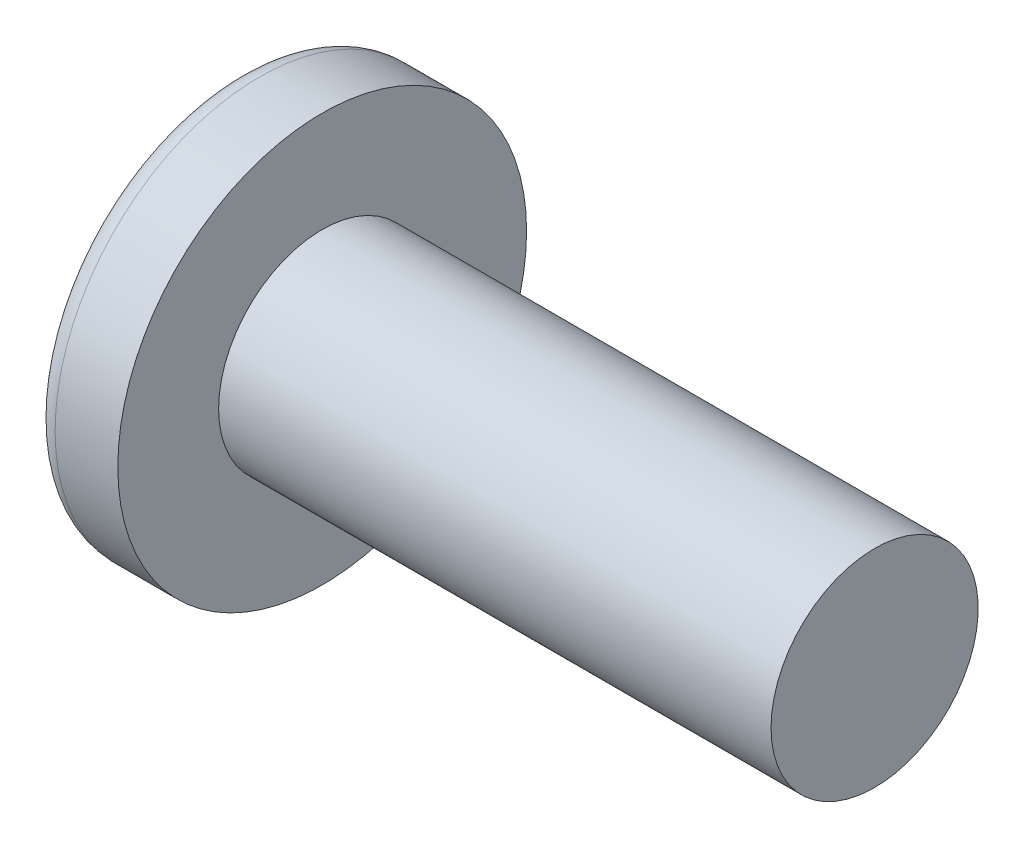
SolidWorks part; units mm, degrees
ref_plane "Plane1" through (0, 0, 0) normal (0, 0, 1) x (1, 0, 0)
ref_plane "Plane2" through (0, 0, 0) normal (0, 1, 0) x (1, 0, 0)
ref_plane "Plane3" through (0, 0, 0) normal (1, 0, 0) x (0, 0, -1)
sketch "BodySke" plane through (0, 0, 0) normal (0, 0, 1) x (1, 0, 0)
  line L0 (6.6294, 4.7625) -> (6.6294, 9.398)
  line L1 (7.159, 6.35) -> (7.159, -3.175) construction
  line L2 (-25.4, 0) -> (127, 0) construction
  line L3 (32.0294, 0) -> (0, 0)
  line L4 (6.6294, 4.7625) -> (32.0294, 4.7625)
  line L5 (32.0294, 4.7625) -> (32.0294, 0)
  line L6 (3.7481, 9.398) -> (6.6294, 9.398)
  line L7 (6.6294, -4.7625) -> (32.0294, -4.7625) construction
  line L8 (6.6294, 6.35) -> (6.6294, -3.175) construction
  arc A0 (2.9272, 8.9807) -> (0, 0) centre (15.24, 0) ccw
  arc A2 (2.9272, 8.9807) -> (3.7481, 9.398) centre (3.7481, 8.382) cw
revolve "Base-Revolve" add sketch "BodySke" angle 360 about L2
sketch "Sketch3" plane through (0, 0, 0) normal (1, 0, 0) x (0, 0, -1)
  line L0 (1.0287, -6.096) -> (-1.0287, -6.096)
  line L1 (1.0287, -6.096) -> (1.0287, 6.096)
  line L2 (-1.0287, 6.096) -> (1.0287, 6.096)
  line L3 (-1.0287, 6.096) -> (-1.0287, -6.096)
ref_plane "Plane4" through (7.2644, 0, 0) normal (1, 0, 0) x (0, 0, -1)
sketch "Sketch4" plane through (7.2644, 0, 0) normal (1, 0, 0) x (0, 0, -1)
  line L0 (0.5143, -0.5143) -> (-0.5143, -0.5144)
  line L1 (0.5143, -0.5143) -> (0.5143, 0.5143)
  line L2 (-0.5143, 0.5143) -> (0.5143, 0.5143)
  line L3 (-0.5143, 0.5143) -> (-0.5143, -0.5144)
loft "Cut-Loft1" cut profiles "Sketch3", "Sketch4"
pattern_circular "CirPattern1" count 2 every 90 about axis through (0, 0, 0) along (1, 0, 0) of "Cut-Loft1"
sketch "ThdSchSke" plane through (0, 0, 0) normal (0, 0, 1) x (1, 0, 0)
  line L0 (7.6886, -4.1326) -> (7.2475, -4.7625)
  line L1 (7.6886, -4.1326) -> (8.1297, -4.7625)
  line L2 (8.1297, -4.7625) -> (8.1297, -5.9531)
  line L3 (-3.175, 0) -> (5.1513, 0) construction
  line L5 (8.1297, -5.9531) -> (7.2475, -5.9531)
  line L6 (7.2475, -5.9531) -> (7.2475, -4.7625)
revolve "ThreadSchematic" [suppressed] cut sketch "ThdSchSke" angle 360 about L3
pattern_linear "ThdSchPat" [suppressed]
equation "\"D1@Sketch3\" = \"Cross_dia@Sketch3\" / 2"
equation "\"D2@Sketch3\" = \"Cross_width@Sketch3\" / 2"
equation "\"D1@Sketch4\" = \"Cross_width@Sketch3\" *.5"
equation "\"D2@Sketch4\" = \"D1@Sketch4\""
equation "\"D3@Sketch4\" = \"D1@Sketch4\" / 2"
equation "\"D4@Sketch4\" = \"D2@Sketch4\" / 2"
equation "\"Thread_length@ThreadCosmetic\" = ((sgn( (\"Length@BodySke\" - \"Advance@BodySke\" ) - \"Thread_nom@BodySke\" )-1)*( (\"Length@BodySke\" - \"Advance@BodySke\" ) - \"Thread_nom@BodySke\" ))/-2+ \"Thread_nom@BodySke\""
equation "\"Thread_minor@ThdSchSke\" = \"Thread_minor@ThreadCosmetic\""
equation "\"Diameter@ThdSchSke\" = \"Diameter@BodySke\""
equation "\"Overcut@ThdSchSke\" = \"Diameter@BodySke\" * 1.25"
equation "\"Start@ThdSchSke\" = \"Head_ht@BodySke\" + \"Length@BodySke\" - \"Thread_length@ThreadCosmetic\"  '---Non-countersunk---"
equation "\"Num_threads@ThdSchPat\" = int( \"Thread_length@ThreadCosmetic\" / \"Advance@BodySke\" + 0.999 )  + 1"
equation "\"Advance@ThdSchPat\" = \"Thread_length@ThreadCosmetic\" /  (\"Num_threads@ThdSchPat\" - 1) 'relax it"
